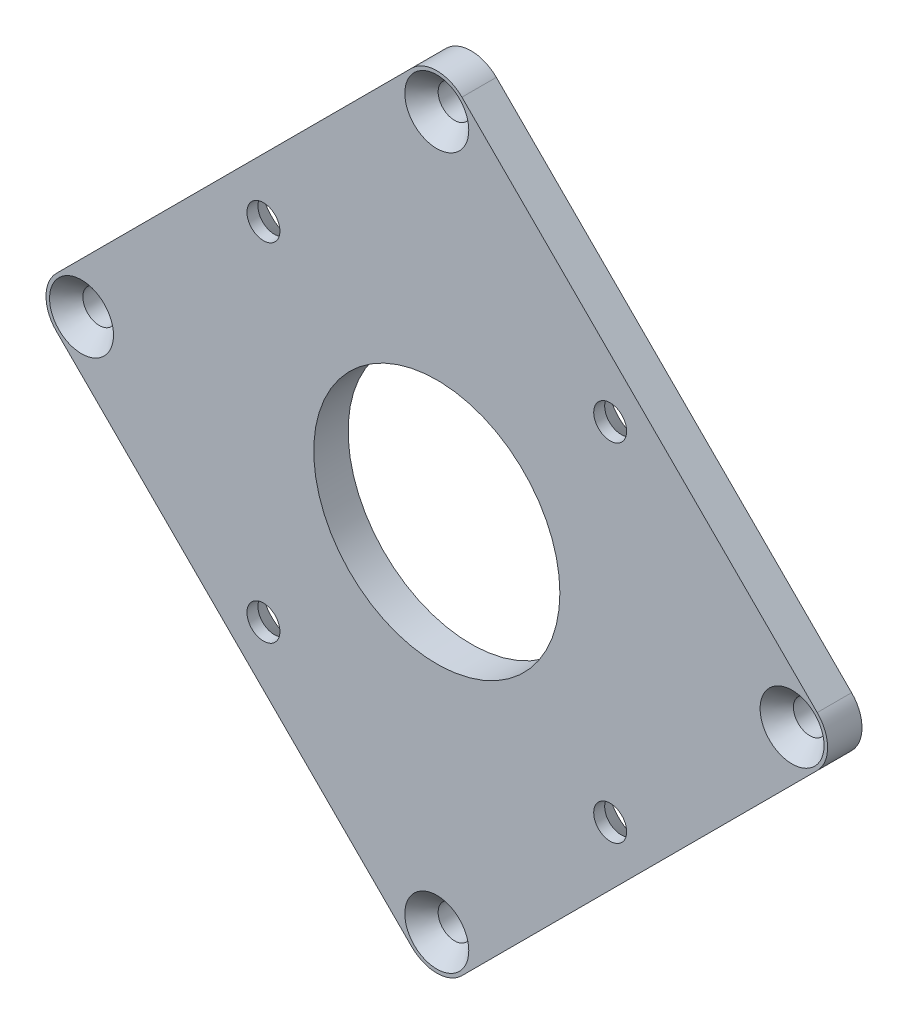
SolidWorks part; units mm, degrees
ref_plane "Front Plane" through (0, 0, 0) normal (0, 0, 1) x (1, 0, 0)
ref_plane "Top Plane" through (0, 0, 0) normal (0, 1, 0) x (1, 0, 0)
ref_plane "Right Plane" through (0, 0, 0) normal (1, 0, 0) x (0, 0, -1)
sketch "Sketch1" plane through (0, 0, 0) normal (0, 0, 1) x (1, 0, 0)
  line L0 (0, 0) -> (0, 36.2401) construction
  line L1 (-2.2451, 33.9951) -> (-33.9951, 2.2451)
  line L2 (-33.9951, -2.2451) -> (-2.2451, -33.9951)
  line L3 (2.2451, -33.9951) -> (33.9951, -2.2451)
  line L4 (33.9951, 2.2451) -> (2.2451, 33.9951)
  line L5 (0, 0) -> (-31.75, 0) construction
  line L6 (-31.75, 0) -> (-34.925, 0) construction
  circle A0 centre (0, 0) radius 25.6256 construction
  circle A1 centre (0, 0) radius 10.9982
  arc A2 (-33.9951, 2.2451) -> (-33.9951, -2.2451) centre (-31.75, 0) ccw
  arc A3 (-2.2451, -33.9951) -> (2.2451, -33.9951) centre (0, -31.75) ccw
  arc A4 (33.9951, -2.2451) -> (33.9951, 2.2451) centre (31.75, 0) ccw
  arc A5 (-2.2451, 33.9951) -> (2.2451, 33.9951) centre (0, 31.75) cw
  circle A6 centre (0, 0) radius 34.925 construction
  circle A7 centre (0, 0) radius 31.75 construction
  dimension "D1" = 63.5
  dimension "D2" = 69.85
  dimension "D3" = 21.9964
extrude "Boss-Extrude1" add sketch "Sketch1" along normal blind 3.0734
hole_wizard "CSK for #4 Flat Head Machine Screw1" positions "Sketch3" profile "Sketch2" countersink size "#4" standard "ANSI Inch"
sketch "Sketch3" plane through (0, 0, 0) normal (0, 0, -1) x (-1, 0, 0)
  line L0 (15.494, -15.494) -> (-15.494, -15.494) construction
  line L1 (-15.494, -15.494) -> (-15.494, 15.494) construction
  line L2 (-15.494, 15.494) -> (15.494, 15.494) construction
  line L3 (15.494, 15.494) -> (15.494, -15.494) construction
  line L6 (0, 0) -> (0, -15.494) construction
  line L8 (0, 0) -> (15.494, 0) construction
  point P0 (15.494, -15.494)
  point P2 (-15.494, -15.494)
  point P4 (-15.494, 15.494)
  point P6 (15.494, 15.494)
  dimension "D1" = 30.988
sketch "Sketch2" plane through (-15.494, -15.494, 0) normal (1, 0, 0) x (0, 1, 0)
  line L0 (0, 0) -> (0, 3.0734)
  line L1 (0, 3.0734) -> (1.4732, 3.0734)
  line L2 (1.4732, 3.0734) -> (1.4732, 2.0925)
  line L3 (1.4732, 2.0925) -> (3.2921, 0)
  line L5 (3.2921, 0) -> (0, 0)
  line L6 (-1.4732, 2.0925) -> (-3.2921, 0) construction
  line L11 (0, -6.35) -> (0, 107.95) construction
  dimension "Thru Hole Dia." = 2.9464
  dimension "Thru Hole Depth" = 3.0734
  dimension "Near C'Sink Dia." = 6.5843
  dimension "Near C'Sink Angle" = 82
hole_wizard "CSK for #4 Flat Head Machine Screw2" positions "Sketch5" profile "Sketch4" countersink size "#4" standard "ANSI Inch"
sketch "Sketch5" plane through (0, 0, 3.0734) normal (0, 0, 1) x (1, 0, 0)
  line L0 (0, -31.75) -> (0, 0) construction
  line L1 (0, 0) -> (-31.75, 0) construction
  line L3 (0, 31.75) -> (0, 0) construction
  line L4 (0, 0) -> (31.75, 0) construction
  circle A0 centre (0, 0) radius 31.75 construction
  point P0 (0, -31.75)
  point P2 (-31.75, 0)
  point P4 (0, 31.75)
  point P6 (31.75, 0)
  dimension "D1" = 63.5
sketch "Sketch4" plane through (0, -31.75, 3.0734) normal (1, 0, 0) x (0, -1, 0)
  line L0 (0, 0) -> (0, 3.0734)
  line L1 (0, 3.0734) -> (1.4732, 3.0734)
  line L2 (1.4732, 3.0734) -> (1.4732, 1.5925)
  line L3 (1.4732, 1.5925) -> (2.8575, 0)
  line L5 (2.8575, 0) -> (0, 0)
  line L6 (-1.4732, 1.5925) -> (-2.8575, 0) construction
  line L11 (0, -6.35) -> (0, 107.95) construction
  dimension "Thru Hole Dia." = 2.9464
  dimension "Thru Hole Depth" = 3.0734
  dimension "Near C'Sink Dia." = 5.715
  dimension "Near C'Sink Angle" = 82
